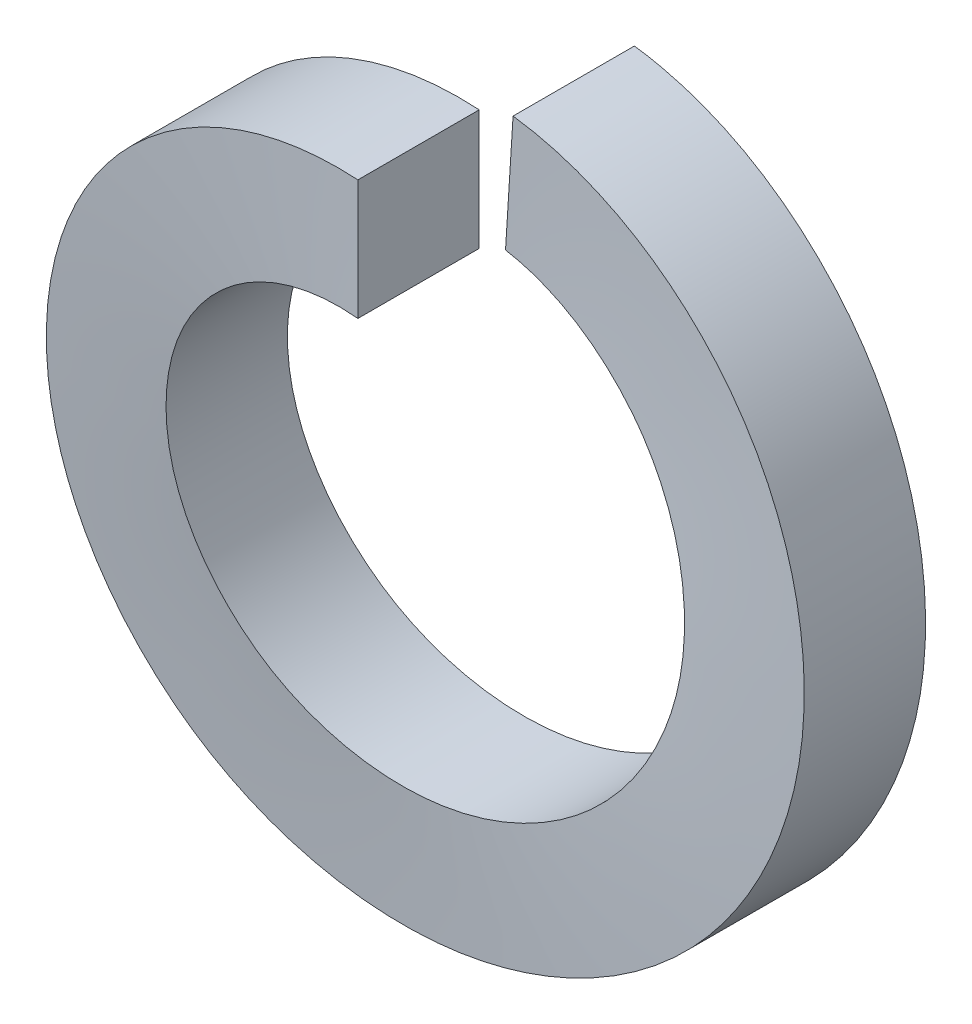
SolidWorks part; units mm, degrees
ref_plane "Front Plane" through (0, 0, 0) normal (0, 0, 1) x (1, 0, 0)
ref_plane "Top Plane" through (0, 0, 0) normal (0, 1, 0) x (1, 0, 0)
ref_plane "Right Plane" through (0, 0, 0) normal (1, 0, 0) x (0, 0, -1)
sketch "Sketch1" plane through (0, 0, 0) normal (0, 0, 1) x (1, 0, 0)
  line L0 (0, 3.3909) -> (0, 2.2098) construction
  circle A0 centre (0, 0) radius 3.3909
  circle A1 centre (0, 0) radius 2.2098 construction
  dimension "ID" = 4.4196
  dimension "OD" = 6.7818
curve "Helix/Spiral1" parameters "HT"=1.3132
sketch "Sketch2" plane through (0, 0, 0) normal (1, 0, 0) x (0, 0, -1)
  line L1 (0, 3.3909) -> (-1.1938, 3.3909)
  line L2 (0, 3.3909) -> (0, 2.2098)
  line L3 (0, 2.2098) -> (-1.1938, 2.2098)
  line L4 (-1.1938, 3.3909) -> (-1.1938, 2.2098)
  dimension "THK" = 1.1938
sweep "Sweep1" add profiles "Sketch2" path "Helix/Spiral1"
equation "\"HT@Helix/Spiral1\" = \"THK@Sketch2\"*1.1"
